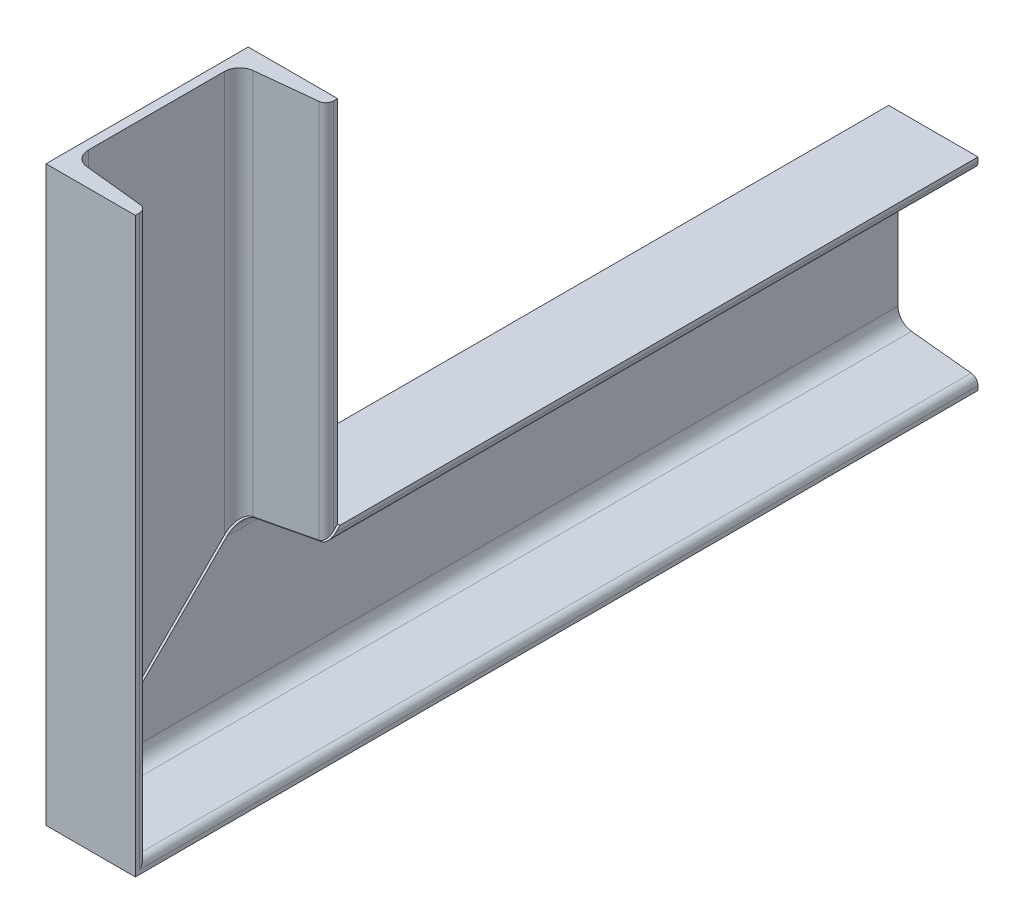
SolidWorks part; units mm, degrees
ref_plane "前视基准面" through (0, 0, 0) normal (0, 0, 1) x (1, 0, 0)
ref_plane "上视基准面" through (0, 0, 0) normal (0, 1, 0) x (1, 0, 0)
ref_plane "右视基准面" through (0, 0, 0) normal (1, 0, 0) x (0, 0, -1)
sketch "草图1" plane through (0, 0, 0) normal (0, 0, 1) x (1, 0, 0)
  line L0 (0, 60) -> (0, -60)
  line L1 (0, -60) -> (53, -60)
  line L2 (53, -60) -> (53, -57.5512)
  line L3 (48.9711, -53.0759) -> (13.5578, -49.3482)
  line L4 (5.5, -40.3976) -> (5.5, 40.3976)
  line L5 (13.5578, 49.3482) -> (48.9711, 53.0759)
  line L6 (53, 57.5512) -> (53, 60)
  line L7 (53, 60) -> (0, 60)
  line L8 (29.25, 60) -> (29.25, 51) construction
  line L9 (29.25, -51) -> (29.25, -60) construction
  arc A0 (5.5, 40.3976) -> (13.5578, 49.3482) centre (14.5, 40.3976) cw
  arc A1 (13.5578, -49.3482) -> (5.5, -40.3976) centre (14.5, -40.3976) cw
  arc A2 (48.9711, 53.0759) -> (53, 57.5512) centre (48.5, 57.5512) ccw
  arc A3 (53, -57.5512) -> (48.9711, -53.0759) centre (48.5, -57.5512) ccw
  point P19 (53, 53.5)
  point P22 (53, -53.5)
  dimension "D11" = 9
  dimension "D12" = 4.5
  dimension "D1" = 120
  dimension "D2" = 5.5
  dimension "D3" = 53
  dimension "D4" = 53
  dimension "D5" = 60
  dimension "D6" = 6.5
  dimension "D7" = 6.5
  dimension "D8" = 23.75
  dimension "D9" = 9
  dimension "D10" = 9
extrude "拉伸1" add sketch "草图1" along normal blind 500
sketch "草图2" plane through (0, -60, 0) normal (0, -1, 0) x (1, 0, 0)
  line L0 (0, 500) -> (0, 380)
  line L1 (0, 500) -> (0, 0) construction
  line L2 (0, 380) -> (53, 380)
  line L3 (53, 500) -> (53, 0) construction
  line L4 (53, 380) -> (53, 382.4488)
  line L5 (48.9711, 386.9241) -> (13.5578, 390.6518)
  line L6 (5.5, 399.6024) -> (5.5, 480.3976)
  line L7 (13.5578, 489.3482) -> (48.9711, 493.0759)
  line L8 (53, 497.5512) -> (53, 500)
  line L9 (53, 500) -> (0, 500)
  line L10 (29.25, 500) -> (29.25, 491) construction
  line L11 (29.25, 389) -> (29.25, 380) construction
  arc A0 (48.9711, 493.0759) -> (53, 497.5512) centre (48.5, 497.5512) ccw
  arc A1 (53, 382.4488) -> (48.9711, 386.9241) centre (48.5, 382.4488) ccw
  arc A2 (5.5, 480.3976) -> (13.5578, 489.3482) centre (14.5, 480.3976) cw
  arc A3 (13.5578, 390.6518) -> (5.5, 399.6024) centre (14.5, 399.6024) cw
  point P20 (53, 493.5)
  point P23 (53, 386.5)
  dimension "D8" = 4.5
  dimension "D9" = 9
  dimension "D1" = 5.5
  dimension "D2" = 6.5
  dimension "D3" = 6.5
  dimension "D4" = 23.75
  dimension "D5" = 9
  dimension "D6" = 9
  dimension "D7" = 120
extrude "拉伸2" add sketch "草图2" against normal blind 340
sketch "草图3" plane through (0, 0, 0) normal (0, 0, -1) x (-1, 0, 0)
  line L0 (-53, 57.5512) -> (-53, -57.5512)
  line L8 (0, 60) -> (-53, 60)
  line L9 (-53, 60) -> (-53, 57.5512)
  line L10 (-48.9711, 53.0759) -> (-13.5578, 49.3482)
  line L11 (-5.5, 40.3976) -> (-5.5, -40.3976)
  line L12 (-13.5578, -49.3482) -> (-48.9711, -53.0759)
  line L13 (-53, -57.5512) -> (-53, -60)
  line L14 (-53, -60) -> (0, -60)
  line L15 (0, -60) -> (0, 60)
  line L18 (-48.9711, 53.0759) -> (-13.5578, 49.3482)
  line L19 (-5.5, 40.3976) -> (-5.5, -40.3976)
  line L20 (-13.5578, -49.3482) -> (-48.9711, -53.0759)
  arc A4 (-53, 57.5512) -> (-48.9711, 53.0759) centre (-48.5, 57.5512) ccw
  arc A5 (-5.5, 40.3976) -> (-13.5578, 49.3482) centre (-14.5, 40.3976) ccw
  arc A6 (-13.5578, -49.3482) -> (-5.5, -40.3976) centre (-14.5, -40.3976) ccw
  arc A7 (-48.9711, -53.0759) -> (-53, -57.5512) centre (-48.5, -57.5512) ccw
  arc A8 (-53, 57.5512) -> (-48.9711, 53.0759) centre (-48.5, 57.5512) ccw
  arc A9 (-5.5, 40.3976) -> (-13.5578, 49.3482) centre (-14.5, 40.3976) ccw
  arc A10 (-13.5578, -49.3482) -> (-5.5, -40.3976) centre (-14.5, -40.3976) ccw
  arc A11 (-48.9711, -53.0759) -> (-53, -57.5512) centre (-48.5, -57.5512) ccw
  dimension "D1" = 0
extrude "切除-拉伸1" cut sketch "草图3" against normal blind 450
sketch "草图4" plane through (0, 60, 0) normal (0, 1, 0) x (-1, 0, 0)
  line L4 (-13.5578, 489.3482) -> (-48.9711, 493.0759)
  line L5 (-53, 497.5512) -> (-53, 382.4488)
  line L6 (-48.9711, 386.9241) -> (-13.5578, 390.6518)
  line L7 (-5.5, 399.6024) -> (-5.5, 480.3976)
  line L8 (-13.5578, 489.3482) -> (-48.9711, 493.0759)
  line L9 (-53, 497.5512) -> (-53, 382.4488)
  line L10 (-48.9711, 386.9241) -> (-13.5578, 390.6518)
  line L11 (-5.5, 399.6024) -> (-5.5, 480.3976)
  arc A4 (-53, 497.5512) -> (-48.9711, 493.0759) centre (-48.5, 497.5512) ccw
  arc A5 (-48.9711, 386.9241) -> (-53, 382.4488) centre (-48.5, 382.4488) ccw
  arc A6 (-13.5578, 390.6518) -> (-5.5, 399.6024) centre (-14.5, 399.6024) ccw
  arc A7 (-5.5, 480.3976) -> (-13.5578, 489.3482) centre (-14.5, 480.3976) ccw
  arc A8 (-53, 497.5512) -> (-48.9711, 493.0759) centre (-48.5, 497.5512) ccw
  arc A9 (-48.9711, 386.9241) -> (-53, 382.4488) centre (-48.5, 382.4488) ccw
  arc A10 (-13.5578, 390.6518) -> (-5.5, 399.6024) centre (-14.5, 399.6024) ccw
  arc A11 (-5.5, 480.3976) -> (-13.5578, 489.3482) centre (-14.5, 480.3976) ccw
  dimension "D1" = 0
extrude "切除-拉伸2" cut sketch "草图4" against normal blind 50
sketch "草图5" plane through (0, 0, 0) normal (-1, 0, 0) x (0, 0, 1)
  line L0 (500, -60) -> (380, 60) construction
  line L1 (480.2409, -38.8267) -> (366.3892, 75.025)
  line L2 (366.3892, 75.025) -> (364.975, 73.6108)
  line L3 (364.975, 73.6108) -> (478.8267, -40.2409)
  line L4 (478.8267, -40.2409) -> (480.2409, -38.8267)
  dimension "D1" = 2
  dimension "D2" = 1
extrude "切除-拉伸3" cut sketch "草图5" against normal blind 60
